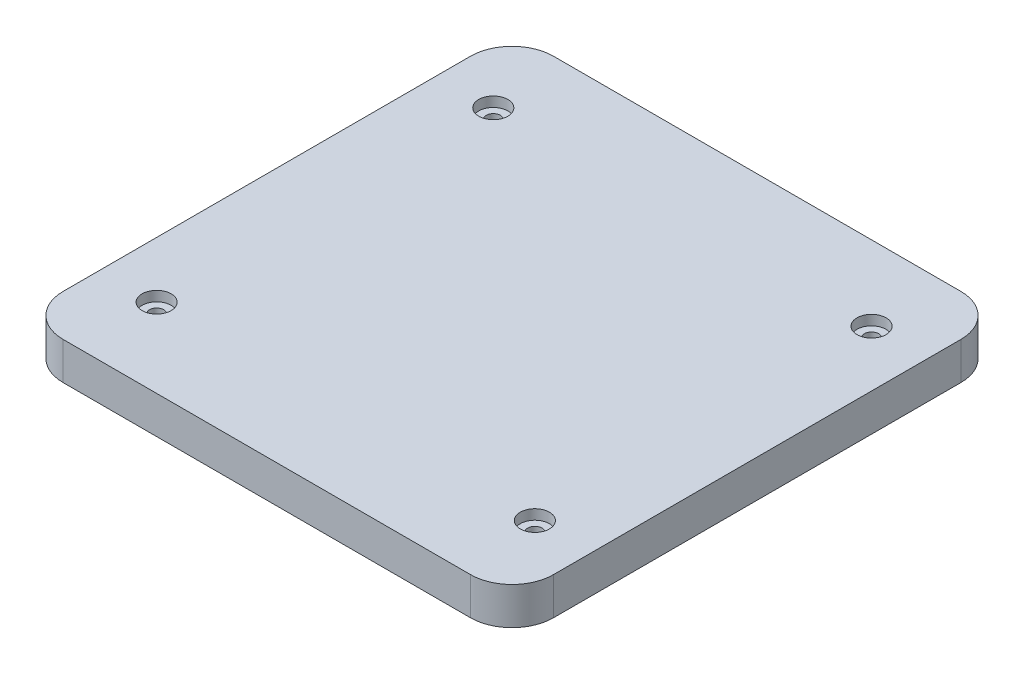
SolidWorks part; units mm, degrees
ref_plane "Front Plane" through (0, 0, 0) normal (0, 0, 1) x (1, 0, 0)
ref_plane "Top Plane" through (0, 0, 0) normal (0, 1, 0) x (1, 0, 0)
ref_plane "Right Plane" through (0, 0, 0) normal (1, 0, 0) x (0, 0, -1)
body saved out of another part "Stock-V1-1"
move or copy body "Body-Move/Copy1" bodies to move or copy 101 copy no rotation origin (-85, 0, 100) rotation axis (0, 1, 0) rotation angle 180
